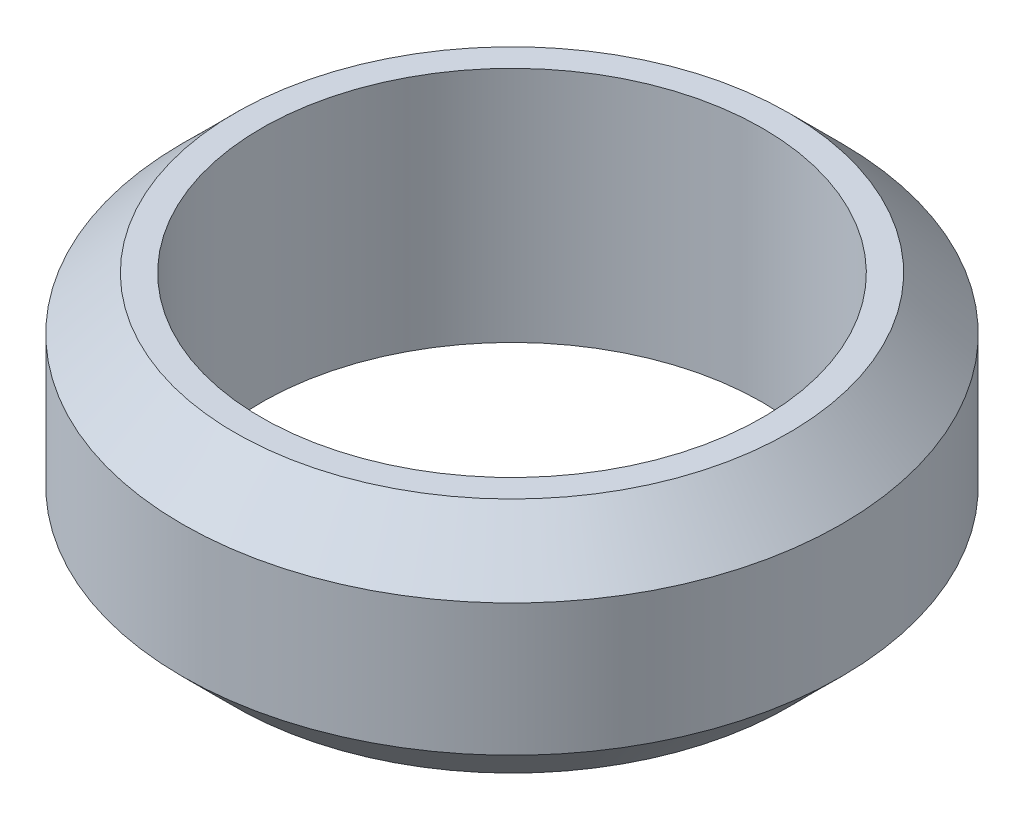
SolidWorks part; units mm, degrees
ref_plane "Alzado" through (0, 0, 0) normal (0, 0, 1) x (1, 0, 0)
ref_plane "Planta" through (0, 0, 0) normal (0, 1, 0) x (1, 0, 0)
ref_plane "Vista lateral" through (0, 0, 0) normal (1, 0, 0) x (0, 0, -1)
sketch "Croquis2" plane through (0, 0, 0) normal (0, 0, 1) x (1, 0, 0)
  line L0 (-21, 13.6071) -> (-19, 13.6071)
  line L1 (-19, 13.6071) -> (-19, -4.3929)
  line L2 (-21, -4.3929) -> (-25, -0.3929)
  line L3 (-25, -0.3929) -> (-25, 9.6071)
  line L4 (-25, 9.6071) -> (-21, 13.6071)
  line L5 (-19, -4.3929) -> (-21, -4.3929)
  line L6 (0, 0) -> (0, 29.6429) construction
  dimension "D1" = 10
  dimension "D2" = 18
  dimension "D3" = 4
  dimension "D4" = 2
  dimension "D5" = 225
  dimension "D6" = 25
revolve "Revolución1" add sketch "Croquis2" angle 360 about L6
